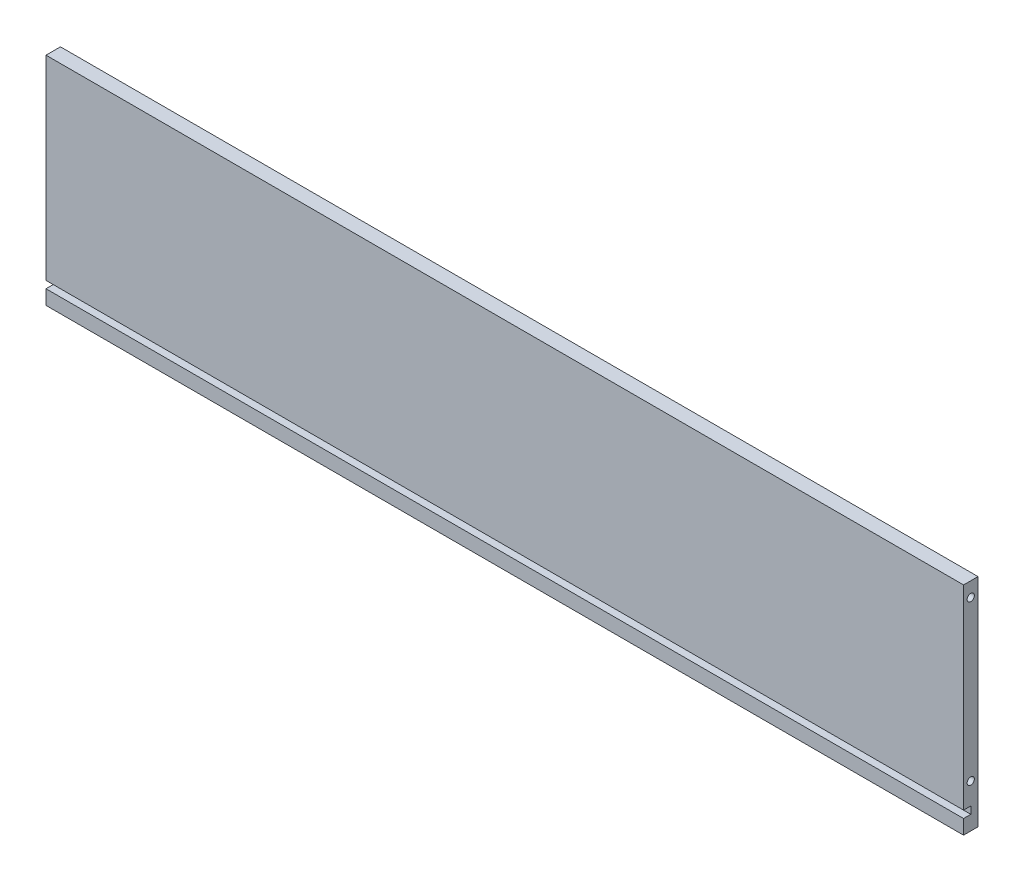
SolidWorks part; units mm, degrees
ref_plane "Front" through (0, 0, 0) normal (0, 0, 1) x (1, 0, 0)
ref_plane "Top" through (0, 0, 0) normal (0, 1, 0) x (1, 0, 0)
ref_plane "Right" through (0, 0, 0) normal (1, 0, 0) x (0, 0, -1)
sketch "Sketch1" plane through (0, 0, 0) normal (0, 0, 1) x (1, 0, 0)
  line L0 (317.5, 80) -> (-317.5, -70) construction
  line L1 (-317.5, -70) -> (317.5, -70)
  line L2 (-317.5, -70) -> (-317.5, 80)
  line L3 (-317.5, 80) -> (317.5, 80)
  line L4 (317.5, -70) -> (317.5, 80)
  line L5 (317.5, -55) -> (317.5, 80) construction
extrude "Base-Extrude" add sketch "Sketch1" along normal blind 10
sketch "Sketch2" plane through (317.5, 0, 0) normal (1, 0, 0) x (0, 0, -1)
  line L0 (-10, -70) -> (-10, 80) construction
  line L1 (-10, -60) -> (-5, -60)
  line L2 (-10, -60) -> (-10, -55)
  line L3 (-10, -55) -> (-5, -55)
  line L4 (-5, -60) -> (-5, -55)
  line L5 (-10, -70) -> (0, -70) construction
  dimension "D1" = 5
  dimension "D2" = 5
  dimension "D3" = 10
extrude "Cut-Extrude1" cut sketch "Sketch2" against normal through all
hole_wizard "M5.0 (5.000000) Diameter Hole1" positions "Sketch5" profile "Sketch4" hole size "M5.0" standard "Ansi Metric"
sketch "Sketch5" plane through (317.5, 0, 0) normal (1, 0, 0) x (0, 0, -1)
  line L0 (-5, 80) -> (-5, -70) construction
  line L1 (-10, -70) -> (0, -70) construction
  line L2 (-10, 80) -> (0, 80) construction
  point P0 (-5, 70)
  point P6 (-5, -40)
  dimension "D1" = 10
  dimension "D2" = 30
sketch "Sketch4" plane through (317.5, 70, 5) normal (0, 1, 0) x (0, 0, -1)
  line L0 (0, 0) -> (0, 16.5022)
  line L1 (0, 16.5022) -> (2.5, 15)
  line L2 (2.5, 15) -> (2.5, 0)
  line L5 (2.5, 0) -> (0, 0)
  line L10 (0, 16.5022) -> (-2.5, 15) construction
  line L11 (0, -6.35) -> (0, 107.95) construction
  dimension "Hole Dia." = 5
  dimension "Hole Depth" = 15
  dimension "Drill Angle" = 118
mirror "Mirror1" about plane through (0, 0, 0) normal (1, 0, 0) of "M5.0 (5.000000) Diameter Hole1"
